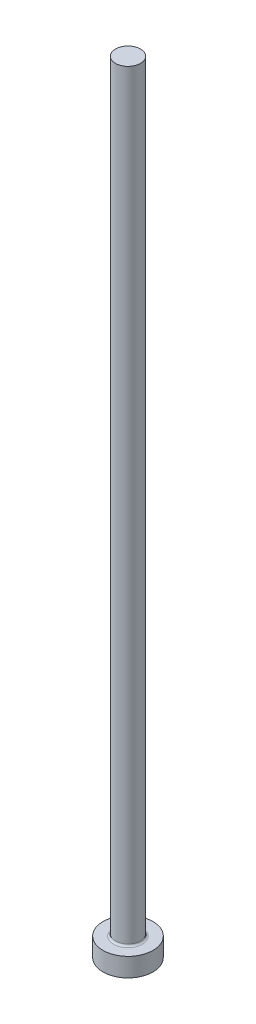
SolidWorks part; units mm, degrees
ref_plane "Plano frontal" through (0, 0, 0) normal (0, 0, 1) x (1, 0, 0)
ref_plane "Plano superior" through (0, 0, 0) normal (0, 1, 0) x (1, 0, 0)
ref_plane "Plano direito" through (0, 0, 0) normal (1, 0, 0) x (0, 0, -1)
sketch "Esboço1" plane through (0, 0, 0) normal (0, 0, 1) x (1, 0, 0)
  line L0 (0, 0) -> (4, 0)
  line L1 (4, 0) -> (4, 3)
  line L2 (4, 3) -> (2.3, 3)
  line L3 (2, 3.3) -> (2, 125)
  line L4 (2, 125) -> (0, 125)
  line L5 (0, 125) -> (0, 0) construction
  line L6 (0, 0) -> (0, 125)
  arc A0 (2.3, 3) -> (2, 3.3) centre (2.3, 3.3) cw
  dimension "D3" = 0.3
  dimension "D1" = 8
  dimension "D2" = 4
  dimension "D4" = 3
  dimension "D5" = 125
revolve "Revolução1" add sketch "Esboço1" angle 360 about L5
sketch "Esboço2"
  dimension "D1" = 0.45
  dimension "D2" = 0.7
  dimension "D3" = 0.3
  dimension "D4" = 2.15
wrap "Envolver1" sketch "Esboço2" wrap type deboss source sketch "Esboço2" thickness 0.1 parameters "D1"=0.1
